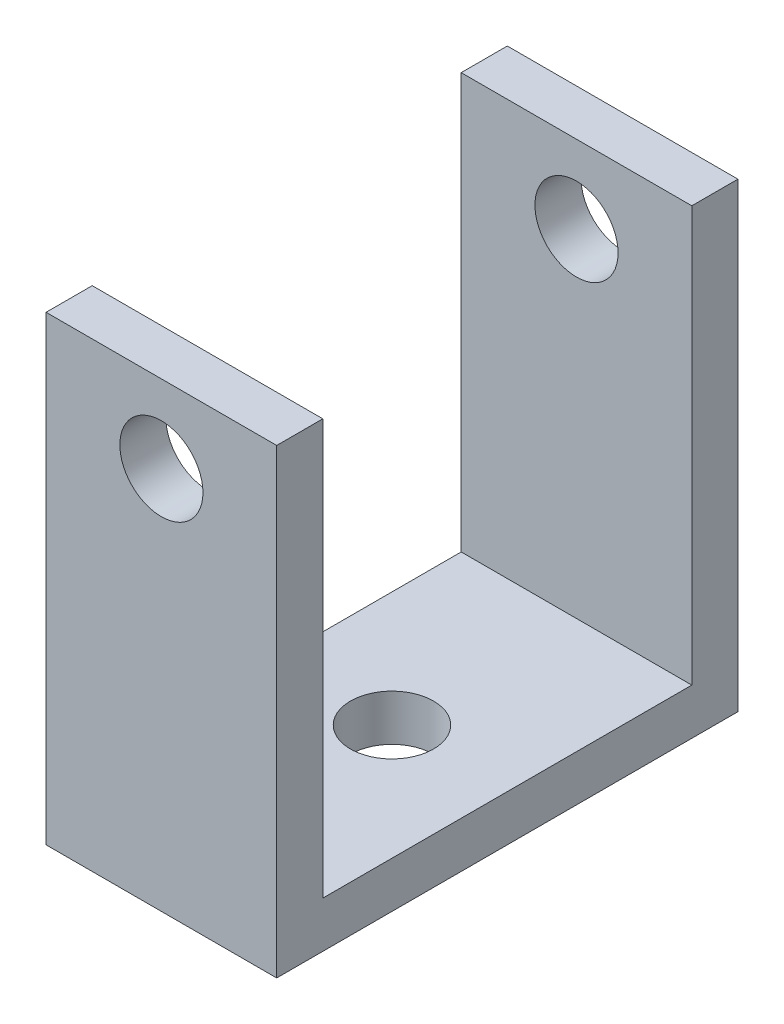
SolidWorks part; units mm, degrees
ref_plane "Front XY" through (0, 0, 0) normal (0, 0, 1) x (1, 0, 0)
ref_plane "Top XZ" through (0, 0, 0) normal (0, 1, 0) x (1, 0, 0)
ref_plane "Right YZ" through (0, 0, 0) normal (1, 0, 0) x (0, 0, -1)
sketch "Sketch1" plane through (0, 0, 0) normal (1, 0, 0) x (0, 0, -1)
  line L1 (-12.7, 25.4) -> (12.7, 25.4) construction
  line L2 (-12.7, 25.4) -> (-12.7, 0)
  line L3 (-12.7, 0) -> (12.7, 0)
  line L4 (12.7, 25.4) -> (12.7, 0)
  line L5 (-12.7, 25.4) -> (12.7, 0) construction
  line L6 (-12.7, 0) -> (12.7, 25.4) construction
  point P0 (0, 12.7)
  dimension "D1" = 25.4
  dimension "D2" = 25.4
extrude "Extrude-Thin1" add sketch "Sketch1" along normal mid plane 12.7 thin
sketch "Sketch2" plane through (0, 0, 0) normal (0, 0, 1) x (1, 0, 0)
  line L0 (0, 0) -> (0, 21.1141) construction
  line L1 (6.35, 25.4) -> (-6.35, 25.4) construction
  circle A0 centre (0, 21.1141) radius 2.2892
  dimension "D1" = 4.2859
  dimension "D2" = 4.5784
extrude "Extrude1" cut sketch "Sketch2" against normal through all and the other way through all
sketch "Sketch3" plane through (0, 0, 0) normal (0, -1, 0) x (1, 0, 0)
  circle A0 centre (0, 0) radius 2.2892
  dimension "D2" = 4.5784
extrude "Extrude2" cut sketch "Sketch3" against normal through all
